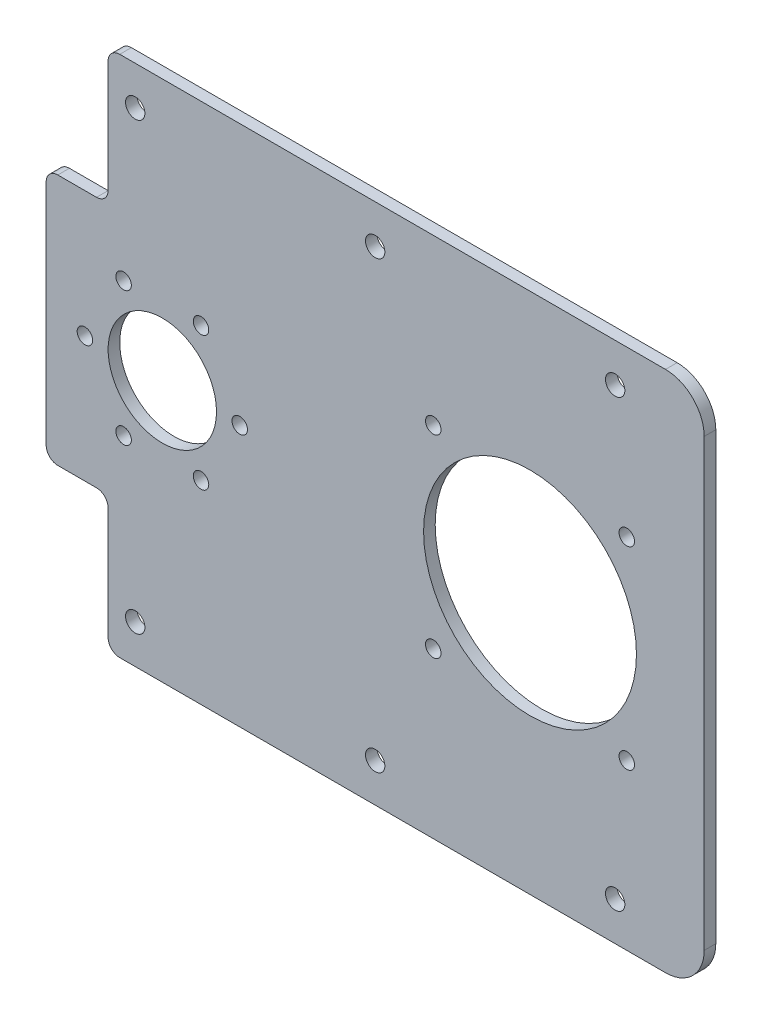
SolidWorks part; units mm, degrees
ref_plane "前视基准面" through (0, 0, 0) normal (0, 0, 1) x (1, 0, 0)
ref_plane "上视基准面" through (0, 0, 0) normal (0, 1, 0) x (1, 0, 0)
ref_plane "右视基准面" through (0, 0, 0) normal (1, 0, 0) x (0, 0, -1)
sketch "草图1" plane through (0, 0, 0) normal (0, 0, 1) x (1, 0, 0)
  line L0 (-55, 0) -> (0, 0) construction
  line L1 (-85, -67.5) -> (85, -67.5)
  line L2 (-85, -67.5) -> (-85, 67.5)
  line L3 (-85, 67.5) -> (85, 67.5)
  line L4 (85, -67.5) -> (85, 67.5)
  line L5 (-85, -67.5) -> (85, 67.5) construction
  line L6 (-85, 67.5) -> (85, -67.5) construction
  circle A0 centre (-55, 0) radius 14
  point P0 (0, 0)
  dimension "D4" = 28
  dimension "D3" = 30
  dimension "D1" = 170
  dimension "D2" = 135
extrude "凸台-拉伸1" add sketch "草图1" along normal mid plane 3
sketch "草图2" plane through (0, 0, 0) normal (0, 0, 1) x (1, 0, 0)
  line L0 (-85, 67.5) -> (-85, -67.5) construction
  line L2 (40, 0) -> (85, 0) construction
  line L3 (85, -67.5) -> (85, 67.5) construction
  circle A0 centre (40, 0) radius 27.5
  dimension "D1" = 55
  dimension "D2" = 125
extrude "切除-拉伸1" cut sketch "草图2" against normal through all both and the other way through all
sketch "草图3" plane through (0, 0, 1.5) normal (0, 0, 1) x (1, 0, 0)
  line L1 (15, -25) -> (65, -25) construction
  line L2 (15, -25) -> (15, 25) construction
  line L3 (15, 25) -> (65, 25) construction
  line L4 (65, -25) -> (65, 25) construction
  line L5 (15, -25) -> (65, 25) construction
  line L6 (15, 25) -> (65, -25) construction
  point P0 (40, 0)
  dimension "D1" = 50
hole_wizard "大小mm 暗销孔1" positions "3D草图1" profile "草图4" hole size "Ø4.0" standard "GB"
sketch3d "3D草图1"
  point P0 (15, 25, 1.5)
  point P3 (65, 25, 1.5)
  point P6 (15, -25, 1.5)
  point P9 (65, -25, 1.5)
sketch "草图4" plane through (15, 25, 1.5) normal (1, 0, 0) x (0, -1, 0)
  line L0 (0, 0) -> (0, 7.7017)
  line L1 (0, 7.7017) -> (2, 6.5)
  line L2 (2, 6.5) -> (2, 0)
  line L5 (2, 0) -> (0, 0)
  line L10 (0, 7.7017) -> (-2, 6.5) construction
  line L11 (0, -6.35) -> (0, 107.95) construction
  dimension "孔直径" = 4
  dimension "孔深度" = 6.5
  dimension "导头角度" = 118
sketch "yaw回转范围" plane through (0, 0, 1.5) normal (0, 0, 1) x (1, 0, 0)
  circle A0 centre (40, 0) radius 55
  dimension "D1" = 110
sketch "草图5" plane through (0, 0, 1.5) normal (0, 0, 1) x (1, 0, 0)
  line L0 (149.2261, 0) -> (-150.7739, 0) construction
  line L1 (85, -67.5) -> (85, 67.5) construction
  line L2 (85, 67.5) -> (-85, 67.5) construction
  line L3 (-85, 67.5) -> (-85, -67.5) construction
  circle A0 centre (62, 57.5) radius 2.5
  circle A1 centre (0, 57.5) radius 2.5
  circle A2 centre (-62, 57.5) radius 2.5
  circle A3 centre (-62, -57.5) radius 2.5
  circle A4 centre (0, -57.5) radius 2.5
  circle A5 centre (62, -57.5) radius 2.5
  circle A6 centre (-75, 0) radius 2
  circle A7 centre (-35, 0) radius 2
  circle A8 centre (-65, -17.3205) radius 2
  circle A9 centre (40, 0) radius 27.5 construction
  circle A10 centre (-55, 0) radius 20 construction
  circle A11 centre (-45, 17.3205) radius 2
  circle A12 centre (-45, -17.3205) radius 2
  circle A13 centre (-65, 17.3205) radius 2
  point P17 (0, 67.5)
  point P33 (-55, 0)
  point P41 (-55, 0)
  dimension "D1" = 5
  dimension "D2" = 5
  dimension "D3" = 5
  dimension "D4" = 23
  dimension "D5" = 10
  dimension "D6" = 23
  dimension "D7" = 4
  dimension "D8" = 95
  dimension "D9" = 40
  dimension "D12" = 4
  dimension "D11" = 20
  dimension "D10" = 3
  dimension "D13" = 3
extrude "切除-拉伸2" cut sketch "草图5" against normal through all
fillet "圆角1" radius 10 2 edges at (85, 67.5, 0) (85, -67.5, 0)
sketch "草图6" plane through (0, 0, 1.5) normal (0, 0, 1) x (1, 0, 0)
  line L0 (-85, 0) -> (85, 0) construction
  line L1 (-85, 67.5) -> (-85, -67.5) construction
  line L2 (85, -57.5) -> (85, 57.5) construction
  line L3 (-85, -67.5) -> (75, -67.5) construction
  line L4 (-85, -32.5) -> (-69, -32.5)
  line L5 (-85, -32.5) -> (-85, -67.5)
  line L6 (-85, -67.5) -> (-69, -67.5)
  line L7 (-69, -32.5) -> (-69, -67.5)
  line L8 (-69, 32.5) -> (-69, 67.5)
  line L9 (-85, 67.5) -> (-69, 67.5)
  line L10 (-85, 32.5) -> (-85, 67.5)
  line L11 (-85, 32.5) -> (-69, 32.5)
  dimension "D1" = 65
  dimension "D2" = 16
extrude "切除-拉伸3" cut sketch "草图6" against normal blind 10
fillet "圆角2" radius 3 6 edges at (-69, 67.5, 0) (-69, 32.5, 0) (-85, 32.5, 0) (-69, -67.5, 0) (-69, -32.5, 0) (-85, -32.5, 0)
